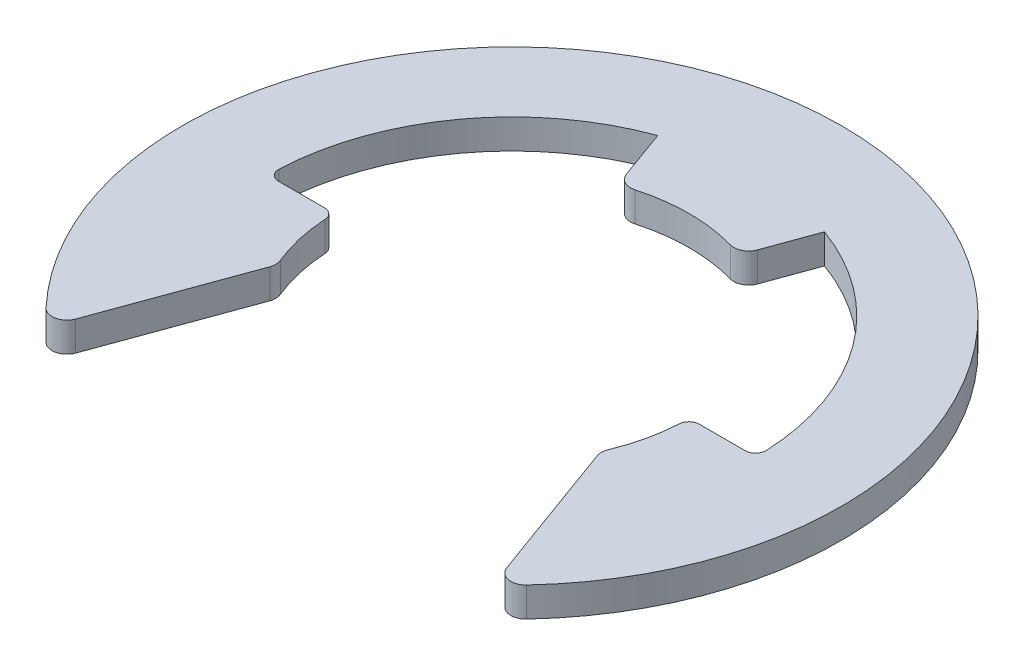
SolidWorks part; units mm, degrees
ref_plane "Front Plane" through (0, 0, 0) normal (0, 0, 1) x (1, 0, 0)
ref_plane "Top Plane" through (0, 0, 0) normal (0, 1, 0) x (1, 0, 0)
ref_plane "Right Plane" through (0, 0, 0) normal (1, 0, 0) x (0, 0, -1)
sketch "Sketch2" plane through (0, 0, 0) normal (0, 1, 0) x (1, 0, 0)
  line L0 (-15.1134, -16.3974) -> (-10.94, -4.9312)
  line L2 (10.94, -4.9312) -> (15.1134, -16.3974)
  line L4 (-12, 0) -> (-16.5, 0)
  line L5 (12, 0) -> (16.5, 0)
  line L6 (-5.6433, 15.5049) -> (-4.1042, 11.2763)
  line L8 (4.1042, 11.2763) -> (5.6433, 15.5049)
  arc A0 (15.1134, -16.3974) -> (-15.1134, -16.3974) centre (0, 0) ccw
  arc A1 (10.94, -4.9312) -> (12, 0) centre (0, 0) ccw
  arc A2 (16.5, 0) -> (5.6433, 15.5049) centre (0, 0) ccw
  arc A3 (-12, 0) -> (-10.94, -4.9312) centre (0, 0) ccw
  arc A4 (4.1042, 11.2763) -> (-4.1042, 11.2763) centre (0, 0) ccw
  arc A5 (-5.6433, 15.5049) -> (-16.5, 0) centre (0, 0) ccw
  point P15 (0, 0)
  point P16 (0, 12)
  dimension "D1" = 44.6
  dimension "D2" = 24
  dimension "D3" = 33
  dimension "D4" = 70
  dimension "D5" = 70
  dimension "D6" = 21.88
  dimension "D7" = 40
extrude "Boss-Extrude1" add sketch "Sketch2" along normal mid plane 2
fillet "Fillet1" radius 1 6 edges at (10.94, 0, 4.9312) (-10.94, 0, 4.9312) (4.1042, 0, -11.2763) (-4.1042, 0, -11.2763) (15.1134, 0, 16.3974) (-15.1134, 0, 16.3974)
fillet "Fillet2" radius 0.7 4 edges at (16.5, 0, 0) (12, 0, 0) (-16.5, 0, 0) (-12, 0, 0)
